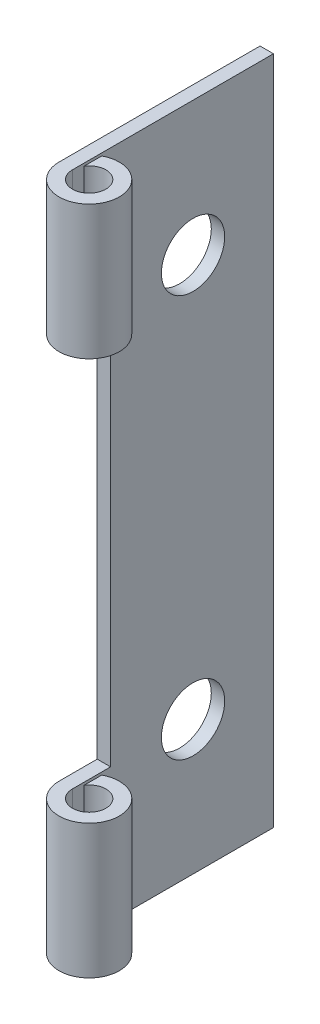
SolidWorks part; units mm, degrees
ref_plane "Front Plane" through (0, 0, 0) normal (0, 0, 1) x (1, 0, 0)
ref_plane "Top Plane" through (0, 0, 0) normal (0, 1, 0) x (1, 0, 0)
ref_plane "Right Plane" through (0, 0, 0) normal (1, 0, 0) x (0, 0, -1)
sketch "Sketch1" plane through (0, 0, 0) normal (1, 0, 0) x (0, 0, -1)
  line L0 (0, 0) -> (0, 31.75) construction
  line L1 (0, 0) -> (9.525, 0) construction
  line L2 (-0.381, 12.7) -> (3.5814, 12.7) construction
  point P3 (1.6002, 12.7)
  point P5 (1.6002, 19.05)
  point P6 (0, 6.35)
  point P9 (-101.6, 31.75)
  point P10 (1.6002, 12.7)
  point P11 (-25.4, 31.75)
  point P12 (-127, 31.75)
sketch "Sketch2" plane through (0, 0, 0) normal (0, 1, 0) x (1, 0, 0)
  line L0 (0.635, 0) -> (2.2225, 0) construction
  line L1 (0, 9.525) -> (0.635, 9.525) construction
  line L2 (-0.6096, 9.3027) -> (0, 9.3027) construction
  line L3 (1.4288, 0.7937) -> (1.4288, 1.4287) construction
  line L5 (1.4288, 1.4287) -> (1.4288, 9.3027) construction
  circle A0 centre (1.4288, 0) radius 0.7938 construction
  point P9 (1.4288, 0.8191)
  point P10 (0.762, 9.3027)
sketch "Sketch3" plane through (0, 0, 0) normal (0, 1, 0) x (1, 0, 0)
  line L0 (0.635, 9.525) -> (0, 9.525)
  line L1 (0, 9.525) -> (0, 0)
  line L2 (0, 0) -> (0, 9.525) construction
  line L3 (0.635, 9.525) -> (0.635, 0)
  line L4 (0.762, 1.2636) -> (0.762, 0.4307)
  arc A0 (0, 0) -> (0.762, 1.2636) centre (1.4288, 0) ccw
  arc A1 (0.635, 0) -> (0.762, 0.4307) centre (1.4288, 0) ccw
extrude "Boss-Extrude1" add sketch "Sketch3" along normal up to vertex (31.75 mm away)
sketch "Sketch4" plane through (0, 0, 0) normal (0, 1, 0) x (1, 0, 0)
  line L0 (0, 0) -> (0, -9.525)
  line L1 (0, -9.525) -> (0.635, -9.525)
  line L2 (0.635, -9.525) -> (0.635, 0)
  line L3 (0.762, -0.4307) -> (0.762, -1.2636)
  line L4 (0.635, 0) -> (2.2225, 0) construction
  line L5 (0, 0) -> (0, 9.525) construction
  arc A0 (0.762, -1.2636) -> (0, 0) centre (1.4288, 0) ccw
  arc A1 (0.762, -0.4307) -> (0.635, 0) centre (1.4288, 0) ccw
sketch "Sketch7" plane through (0, 0, 0) normal (1, 0, 0) x (0, 0, -1)
  line L0 (-1.8097, 38.1) -> (1.8097, 38.1)
  line L1 (-1.8097, 12.7) -> (1.8097, 12.7)
  line L2 (-1.8097, 12.7) -> (-1.8097, 6.35)
  line L3 (-1.8097, 6.35) -> (1.8098, 6.35)
  line L4 (1.8097, 12.7) -> (1.8098, 6.35)
  line L5 (-1.8097, 25.4) -> (1.8097, 25.4)
  line L6 (-1.8097, 25.4) -> (-1.8097, 19.05)
  line L7 (1.8097, 25.4) -> (1.8098, 19.05)
  line L8 (-1.8097, 19.05) -> (1.8098, 19.05)
  line L9 (-1.8097, 12.7) -> (-1.8097, 25.4) construction
  line L10 (-1.8097, 38.1) -> (-1.8097, 31.75)
  line L11 (1.8097, 38.1) -> (1.8098, 31.75)
  line L12 (-1.8097, 31.75) -> (1.8098, 31.75)
  point P5 (0, 6.35)
extrude "Cut-Extrude2" cut sketch "Sketch7" along normal through all
sketch "Sketch8" plane through (0, 0, 0) normal (1, 0, 0) x (0, 0, -1)
  line L0 (-1.8097, 6.35) -> (1.8098, 6.35) construction
  line L1 (-1.8097, 6.35) -> (1.8098, 6.35)
  line L2 (-1.8097, 6.35) -> (-1.8098, 0)
  line L3 (-1.8098, 0) -> (1.8098, 0)
  line L4 (1.8098, 6.35) -> (1.8098, 0)
  line L5 (-1.8097, 12.7) -> (-1.8097, 6.35) construction
  line L6 (-1.8097, 19.05) -> (1.8098, 19.05)
  line L7 (-1.8097, 19.05) -> (-1.8098, 12.7)
  line L8 (-1.8098, 12.7) -> (1.8098, 12.7)
  line L9 (1.8098, 19.05) -> (1.8098, 12.7)
  line L10 (-1.8097, 6.35) -> (-1.8097, 19.05) construction
  line L11 (-1.8097, 31.75) -> (1.8098, 31.75)
  line L12 (-1.8097, 31.75) -> (-1.8098, 25.4)
  line L13 (-1.8098, 25.4) -> (1.8098, 25.4)
  line L14 (1.8098, 31.75) -> (1.8098, 25.4)
sketch "Sketch10" plane through (0, 0, 0) normal (1, 0, 0) x (0, 0, -1)
  line L1 (1.8097, 19.05) -> (-1.8098, 19.05)
  line L2 (1.8097, 19.05) -> (1.8098, 12.7)
  line L3 (1.8098, 12.7) -> (-1.8098, 12.7)
  line L4 (-1.8098, 19.05) -> (-1.8098, 12.7)
  line L5 (-1.8097, 6.35) -> (1.8098, 6.35) construction
  line L7 (0, 0) -> (0, 31.75) construction
  point P4 (0, 12.7)
extrude "Cut-Extrude4" cut sketch "Sketch10" along normal through all
sketch "Sketch9" plane through (0, 0, 0) normal (0, 1, 0) x (1, 0, 0)
  line L0 (0.635, 0) -> (2.2225, 0) construction
  circle A0 centre (1.4288, 0) radius 0.7938
ref_plane "Plane1" through (0, 13.0048, 0) normal (0, 1, 0) x (1, 0, 0)
sketch "Sketch11" plane through (0, 13.0048, 0) normal (0, 1, 0) x (1, 0, 0)
  circle A0 centre (1.4288, 0) radius 1.4287
curve "Helix/Spiral1"
ref_plane "Plane2" through (0, 18.7452, 0) normal (0, 1, 0) x (1, 0, 0)
sketch "Sketch12" plane through (0, 13.0048, 0) normal (0, 1, 0) x (1, 0, 0)
  line L0 (0, 9.3027) -> (0, 2.1431)
  line L1 (1.4288, 1.4287) -> (0.7144, 1.4287)
  line L2 (-0.6096, 9.3027) -> (0, 9.3027) construction
  line L3 (0.7144, 2.1431) -> (0.7144, 1.4287) construction
  arc A0 (0.7144, 1.4287) -> (0, 2.1431) centre (0.7144, 2.1431) cw
sketch "Sketch13" plane through (0, 18.7452, 0) normal (0, 1, 0) x (1, 0, 0)
  line L0 (0, -2.1431) -> (0, -9.3027)
  line L1 (0, 9.3027) -> (0, 2.1431) construction
  line L2 (0.7144, -1.4287) -> (1.4288, -1.4287)
  line L3 (1.4288, 1.4287) -> (0.7144, 1.4287) construction
  arc A0 (0, -2.1431) -> (0.7144, -1.4287) centre (0.7144, -2.1431) cw
  circle A2 centre (1.4288, 0) radius 1.4287 construction
curve "CompCurve1"
ref_plane "Plane3" through (0, 0, -9.3027) normal (0, 0, 1) x (1, 0, 0)
sketch "Sketch14" plane through (0, 0, -9.3027) normal (0, 0, 1) x (1, 0, 0)
  line L0 (-0.3048, 0) -> (-0.3048, 13.0048) construction
  line L1 (-0.6096, 0) -> (0, 0) construction
  line L3 (2.8575, 13.0048) -> (0, 13.0048) construction
  circle A0 centre (-0.3048, 13.0048) radius 0.3048
sketch "Sketch15" plane through (0.635, 0, 0) normal (1, 0, 0) x (0, 0, -1)
  line L0 (9.525, 31.75) -> (9.525, 0) construction
  line L1 (0, 0) -> (9.525, 0) construction
  line L2 (0, 31.75) -> (9.525, 31.75) construction
  circle A0 centre (5.715, 6.35) radius 1.5
  circle A1 centre (5.715, 25.4) radius 1.5
  point P11 (5.715, 6.35)
  dimension "D1" = 3
  dimension "D4" = 3
  dimension "D2" = 3.81
  dimension "D3" = 6.35
  dimension "D5" = 3.81
  dimension "D6" = 6.35
extrude "Cut-Extrude5" cut sketch "Sketch15" against normal through all
equation "\"Num Knuckles\"=5"
equation "\"D1@Sketch7\"=\"Knuckle Length@Sketch1\""
equation "\"D2@Sketch7\" = ( 2 * \"Leaf Thickness@Sketch2\" ) + \"Pin Dia@Sketch2\" + ( .04 * \"Overall Width@Sketch1\" )"
equation "\"D4@Sketch7\"=\"Knuckle Length@Sketch1\"*2"
equation "\"D3@Sketch7\" = int ( \"Num Knuckles@Sketch1\" / 2 )  + 1"
equation "\"D2@Sketch8\"=\"D4@Sketch7\""
equation "\"D1@Sketch8\"=\"D3@Sketch7\""
equation "\"Spring Knuckles\"= 1"
equation "\"D1@Sketch10\"= \"Knuckle Length@Sketch1\" * \"Spring Knuckles@Sketch1\""
equation "\"D2@Sketch10\"=\"Knuckle Length@Sketch1\"*(\"Num Knuckles@Sketch1\"-\"Spring Knuckles@Sketch1\")/2"
equation "\"D1@Plane1\"=\"D2@Sketch10\"+(\"Wire Dia@Sketch2\"/2)"
equation "\"D3@Helix/Spiral1\"=(\"Spring Knuckles@Sketch1\"*\"Knuckle Length@Sketch1\")-\"Wire Dia@Sketch2\""
equation "\"D1@Plane2\"=\"D3@Helix/Spiral1\""
equation "\"D1@Sketch14\"=\"Wire Dia@Sketch2\""
equation "\"Num Holes\"=4"
equation "\"D1@Sketch1\"=\"Length Corner@Sketch1\""
equation "\"D1@Sketch2\"= \"Wire Dia@Sketch2\""
equation "\"Knuckle Length@Sketch1\"=\"Leaf Height@Sketch1\"/\"Num Knuckles@Sketch1\""
